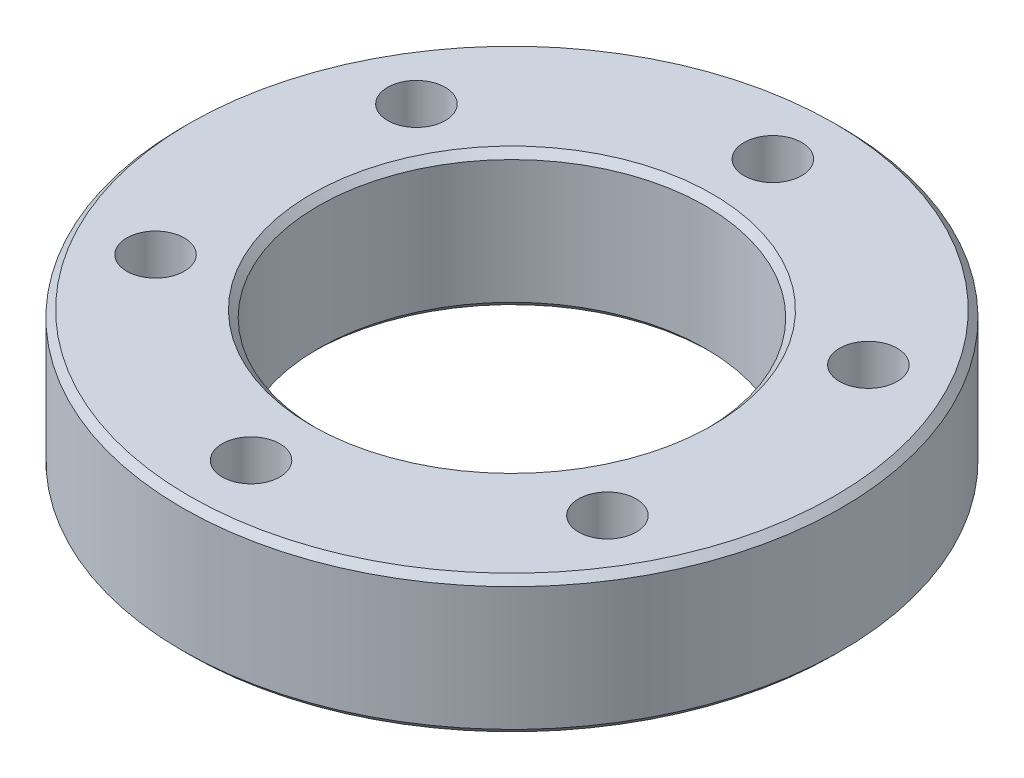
SolidWorks part; units mm, degrees
ref_plane "Plan1" through (0, 0, 0) normal (0, 0, 1) x (1, 0, 0)
ref_plane "Plan2" through (0, 0, 0) normal (0, 1, 0) x (1, 0, 0)
ref_plane "Plan3" through (0, 0, 0) normal (1, 0, 0) x (0, 0, -1)
sketch "Esquisse1" plane through (0, 0, 0) normal (0, 1, 0) x (1, 0, 0)
  circle A0 centre (0, 0) radius 14.1
  circle A1 centre (0, 0) radius 24
  dimension "D1" = 28.2
  dimension "D2" = 48
extrude "Boss.-Extru.1" add sketch "Esquisse1" along normal blind 10
hole_wizard "Trou taraudé M51" positions "Esquisse2" profile "Esquisse3" tap size "M5" standard "ISO"
sketch "Esquisse2" plane through (0, 10, 0) normal (0, 1, 0) x (1, 0, 0)
  circle A0 centre (0, 0) radius 19
  point P4 (0, 19)
  dimension "D1" = 38
sketch "Esquisse3" plane through (0, 10, -19) normal (1, 0, 0) x (0, 0, 1)
  line L0 (0, 0) -> (0, 10)
  line L1 (0, 10) -> (2.1, 10)
  line L2 (2.1, 10) -> (2.1, 0)
  line L5 (2.1, 0) -> (0, 0)
  line L11 (0, -6.35) -> (0, 107.95) construction
  dimension "Diamètre du trou pour taraudage jusqu'au prochain" = 4.2
  dimension "Profondeur du trou pour taraudage jusqu'au prochain" = 10
pattern_circular "Répétition circulaire1" count 6 over 360 about axis through (0, 0, 0) along (0, 1, 0) of "Trou taraudé M51"
chamfer "Chanfrein1" distance 0.5 angle 45 4 edges at (0, 0, 24) (0, 10, 24) (0, 0, 14.1) (0, 10, 14.1)
